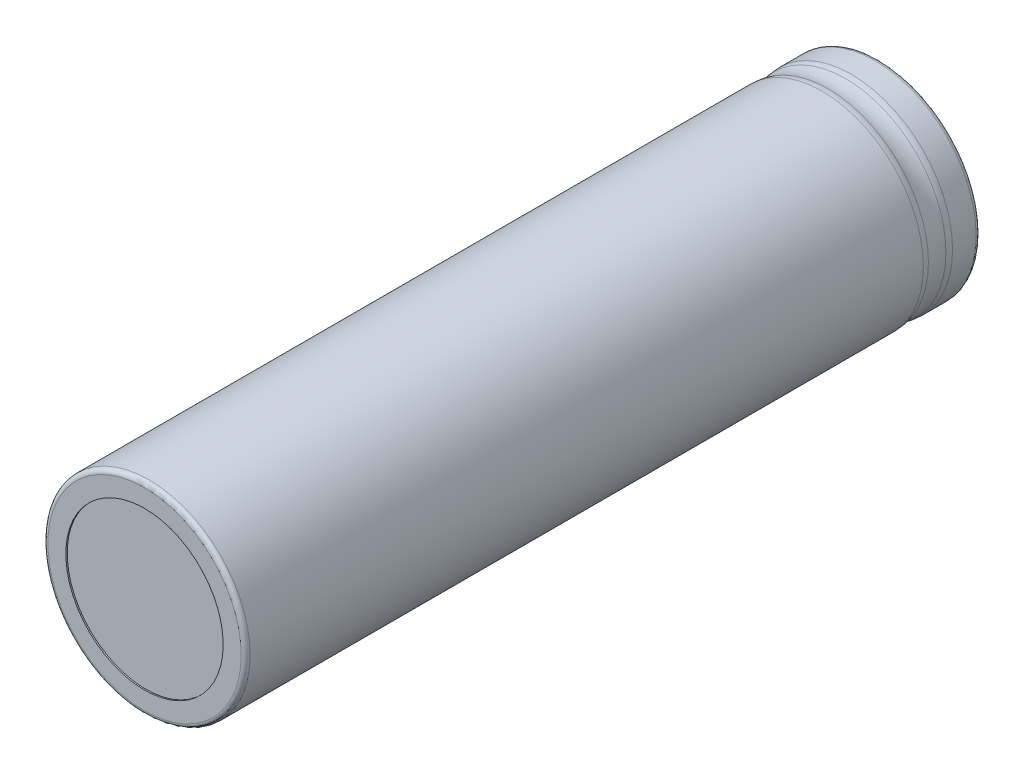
SolidWorks part; units mm, degrees
ref_plane "Front Plane" through (0, 0, 0) normal (0, 0, 1) x (1, 0, 0)
ref_plane "Top Plane" through (0, 0, 0) normal (0, 1, 0) x (1, 0, 0)
ref_plane "Right Plane" through (0, 0, 0) normal (1, 0, 0) x (0, 0, -1)
sketch "Sketch1" plane through (0, 0, 0) normal (0, 0, 1) x (1, 0, 0)
  circle A0 centre (0, 0) radius 9
  dimension "D1" = 18
extrude "Boss-Extrude1" add sketch "Sketch1" along normal blind 65.4
sketch "Sketch4" plane through (0, 0, 65.4) normal (0, 0, 1) x (1, 0, 0)
  circle A0 centre (0, 0) radius 7
  dimension "D1" = 14
extrude "Cut-Extrude1" cut sketch "Sketch4" against normal blind 0.12
sketch "Sketch5" plane through (0, 0, 0) normal (0, 0, -1) x (-1, 0, 0)
  circle A0 centre (0, 0) radius 7.325
  dimension "D1" = 14.65
extrude "Cut-Extrude2" cut sketch "Sketch5" against normal blind 0.12
sketch "Sketch6" plane through (0, 0, 0.12) normal (0, 0, -1) x (-1, 0, 0)
  circle A0 centre (0, 0) radius 5.5
  dimension "D1" = 11
extrude "Cut-Extrude3" cut sketch "Sketch6" against normal blind 1
sketch "Sketch7" plane through (0, 0, 1.12) normal (0, 0, -1) x (-1, 0, 0)
  line L0 (0, 0) -> (3.8863, 3.5313) construction
  line L1 (0, 0) -> (1.1151, -5.1313) construction
  line L2 (0, 0) -> (-5.0014, 1.6) construction
  line L3 (0, 0) -> (2.6255, 4.5476) construction
  line L4 (0, 0) -> (4.7775, 2.1793) construction
  line L5 (0, 0) -> (-0.5015, -5.2271) construction
  line L6 (0, 0) -> (2.6255, -4.5476) construction
  line L7 (0, 0) -> (-4.2761, 3.0478) construction
  line L8 (0, 0) -> (-5.2511, 0) construction
  line L9 (2.6255, 4.5476) -> (4.7775, 2.1793) construction
  line L10 (-4.2761, 3.0478) -> (-5.2511, 0) construction
  line L11 (-0.5015, -5.2271) -> (2.6255, -4.5476) construction
  line L12 (2.6255, 4.5476) -> (2.375, 4.1136)
  line L13 (4.7775, 2.1793) -> (4.3216, 1.9713)
  line L14 (-0.5015, -5.2271) -> (-0.4536, -4.7283)
  line L15 (2.6255, -4.5476) -> (2.375, -4.1136)
  line L16 (-4.75, 0) -> (-5.2511, 0)
  line L17 (-4.2761, 3.0478) -> (-3.868, 2.757)
  arc A0 (-4.2761, 3.0478) -> (-5.2511, 0) centre (0, 0) ccw construction
  arc A1 (-3.868, 2.757) -> (-4.75, 0) centre (0, 0) ccw construction
  arc A2 (-3.868, 2.757) -> (-4.75, 0) centre (0, 0) ccw
  arc A3 (-4.2761, 3.0478) -> (-5.2511, 0) centre (0, 0) ccw
  arc A4 (4.3216, 1.9713) -> (2.375, 4.1136) centre (0, 0) ccw construction
  arc A5 (4.3216, 1.9713) -> (2.375, 4.1136) centre (0, 0) ccw
  arc A6 (4.7775, 2.1793) -> (2.6255, 4.5476) centre (0, 0) ccw construction
  arc A7 (4.7775, 2.1793) -> (2.6255, 4.5476) centre (0, 0) ccw
  arc A8 (-0.4536, -4.7283) -> (2.375, -4.1136) centre (0, 0) ccw construction
  arc A9 (-0.4536, -4.7283) -> (2.375, -4.1136) centre (0, 0) ccw
  arc A10 (-0.5015, -5.2271) -> (2.6255, -4.5476) centre (0, 0) ccw construction
  arc A11 (-0.5015, -5.2271) -> (2.6255, -4.5476) centre (0, 0) ccw
  dimension "D1" = 120
  dimension "D10" = 9.5
  dimension "D2" = 120
  dimension "D3" = 17.74
  dimension "D4" = 17.74
  dimension "D5" = 17.74
  dimension "D6" = 17.74
  dimension "D7" = 17.74
  dimension "D8" = 17.74
  dimension "D9" = 3.2
extrude "Boss-Extrude4" add sketch "Sketch7" along normal blind 1.5
sketch "Sketch8" plane through (0, 0, -0.38) normal (0, 0, -1) x (-1, 0, 0)
  circle A0 centre (0, 0) radius 4.75
extrude "Boss-Extrude5" add sketch "Sketch8" against normal blind 0.5
fillet "Fillet1" radius 0.5 3 edges at (-3.8863, 3.5313, -0.38) (-1.1151, -5.1313, -0.38) (5.0014, 1.6, -0.38)
fillet "Fillet2" radius 0.5 6 edges at (3.868, 2.757, -0.13) (4.75, 0, -0.13) (0.4536, -4.7283, -0.13) (-2.375, -4.1136, -0.13) (-4.3216, 1.9713, -0.13) (-2.375, 4.1136, -0.13)
sketch "Sketch10" plane through (0, 0, 0) normal (0, 1, 0) x (1, 0, 0)
  line L0 (0, 0) -> (0, -3.8) construction
  line L1 (0, -3.8) -> (-9, -3.8) construction
  line L2 (-9, 0) -> (-9, -65.4) construction
  line L3 (-9, -3.8) -> (-9, -4.8)
  line L4 (-9, -3.8) -> (-9, -2.8)
  arc A0 (-9, -2.8) -> (-9, -4.8) centre (-11.8284, -3.8) cw
  dimension "D1" = 3.8
  dimension "D2" = 1
  dimension "D3" = 1
revolve "Cut-Revolve1" cut sketch "Sketch10" angle 360 about L0
fillet "Fillet3" radius 0.4 2 edges at (9, 0, 65.4) (9, 0, 0)
fillet "Fillet4" radius 2 2 edges at (-9, 0, 2.8) (-9, 0, 4.8)
